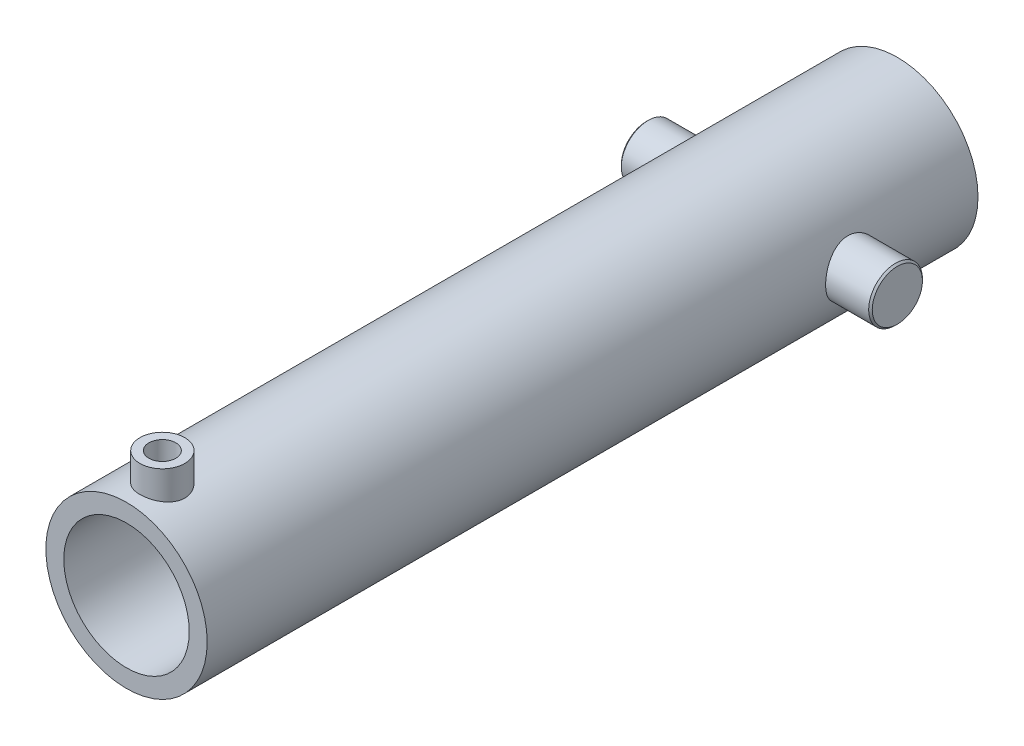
SolidWorks part; units mm, degrees
ref_plane "Plan de face" through (0, 0, 0) normal (0, 0, 1) x (1, 0, 0)
ref_plane "Plan de dessus" through (0, 0, 0) normal (0, 1, 0) x (1, 0, 0)
ref_plane "Plan de droite" through (0, 0, 0) normal (1, 0, 0) x (0, 0, -1)
sketch "Esquisse1" plane through (0, 0, 0) normal (0, 0, 1) x (1, 0, 0)
  circle A0 centre (0, 0) radius 45
  dimension "D1" = 90
extrude "Extru.-Mince1" add sketch "Esquisse1" along normal blind 430 thin
ref_plane "Plan1" through (0, 60, 0) normal (0, 1, 0) x (-1, 0, 0)
sketch "Esquisse2" plane through (0, 60, 0) normal (0, 1, 0) x (-1, 0, 0)
  line L0 (45, 430) -> (-45, 430) construction
  circle A0 centre (0, 410) radius 12.5
  dimension "D1" = 25
  dimension "D2" = 20
extrude "Extrusion2" add sketch "Esquisse2" against normal up to next
sketch "Esquisse3" plane through (0, 60, 0) normal (0, 1, 0) x (-1, 0, 0)
  circle A0 centre (0, 410) radius 7.5
  circle A3 centre (0, 410) radius 12.5 construction
  dimension "D1" = 15
extrude "Enlèv. mat.-Extru.2" cut sketch "Esquisse3" against normal up to surface (25 mm away)
ref_plane "Plan2" through (70, 0, 0) normal (1, 0, 0) x (0, 0, -1)
sketch "Esquisse4" plane through (70, 0, 0) normal (1, 0, 0) x (0, 0, -1)
  line L0 (0, -45) -> (0, 45) construction
  circle A0 centre (-70, 0) radius 15
  dimension "D1" = 30
  dimension "D2" = 70
extrude "Extrusion3" add sketch "Esquisse4" against normal up to surface (25 mm away) separate body
chamfer "Chanfrein1" distance 1 angle 45 1 edges at (70, 0, 55)
pattern_circular "Répétition circulaire2" count 2 over 360 about axis through (0, 0, 0) along (0, 0, 1)
